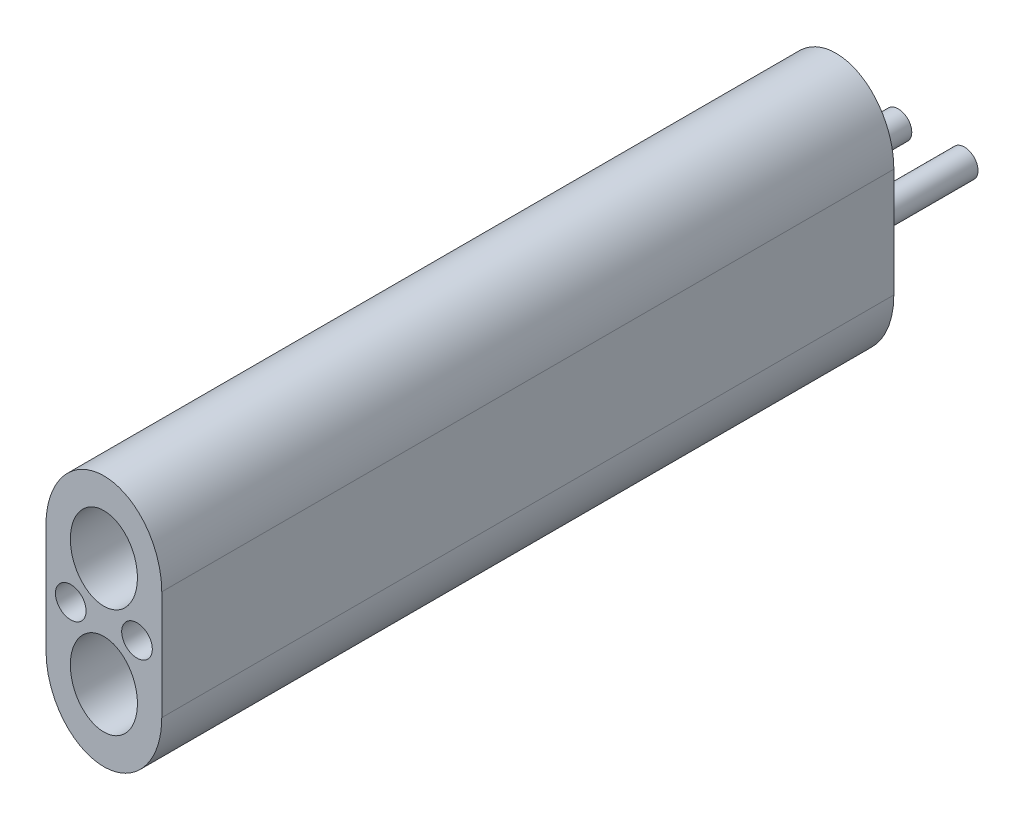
SolidWorks part; units mm, degrees
ref_plane "Front Plane" through (0, 0, 0) normal (0, 0, 1) x (1, 0, 0)
ref_plane "Top Plane" through (0, 0, 0) normal (0, 1, 0) x (1, 0, 0)
ref_plane "Right Plane" through (0, 0, 0) normal (1, 0, 0) x (0, 0, -1)
sketch "Sketch4" plane through (0, 0, 0) normal (0, 0, 1) x (1, 0, 0)
  line L1 (-8.5, 0) -> (8.5, 0)
  ellipse E0 centre (0, 0) end of major axis (0, 10.5) minor radius 8.5 (8.5, 0) -> (-8.5, 0) ccw
  dimension "D2" = 8.5
sketch "Sketch5" plane through (0, 0, 0) normal (1, 0, 0) x (0, 0, -1)
  ellipse E0 centre (0, -8) end of major axis (-15, -8) minor radius 8 (0, 0) -> (0, -16) ccw
  dimension "D1" = 16
sweep "Sweep1" add profiles "Sketch4" path "Sketch5"
sketch "Sketch6" plane through (0, 0, 0) normal (0, 0, -1) x (-1, 0, 0)
  line L0 (-8.5, -16) -> (-8.5, 0)
  line L1 (-8.5, 0) -> (8.5, 0)
  line L2 (8.5, 0) -> (8.5, -16)
  line L3 (8.5, -16) -> (-8.5, -16)
extrude "Boss-Extrude1" add sketch "Sketch6" against normal up to body
sketch "Sketch7" plane through (0, 0, 0) normal (0, 0, -1) x (-1, 0, 0)
  ellipse E0 centre (0, 0) end of major axis (0, 6.0789) minor radius 4.9211
sketch "Sketch8" plane through (0, 0, 0) normal (1, 0, 0) x (0, 0, -1)
  line L1 (0, 0) -> (-7, 0)
  line L2 (0, -6.0789) -> (0, 6.0789) construction
  line L3 (0, -16) -> (-7, -16)
  arc A1 (-7, 0) -> (-7, -16) centre (-7, -8) ccw
sweep "Cut-Sweep1" cut profiles "Sketch7" path "Sketch8"
sketch "Sketch9" plane through (0, 0, 0) normal (0, 0, -1) x (-1, 0, 0)
  line L2 (-8.5, 0) -> (-8.5, -16)
  line L3 (8.5, -16) -> (8.5, 0)
  line L4 (-8.5, 0) -> (-8.5, -16)
  line L5 (8.5, -16) -> (8.5, 0)
  ellipse E0 centre (0, 0) end of major axis (0, 6.0789) minor radius 4.9211 construction
  ellipse E1 centre (0, -16) end of major axis (0, -22.0789) minor radius 4.9211 construction
  ellipse E2 centre (0, 0) end of major axis (0, 10.5) minor radius 8.5 (8.5, 0) -> (-8.5, 0) ccw
  ellipse E3 centre (0, -16) end of major axis (0, -26.5) minor radius 8.5 (-8.5, -16) -> (8.5, -16) ccw
  ellipse E4 centre (0, 0) end of major axis (0, 10.5) minor radius 8.5 (8.5, 0) -> (-8.5, 0) ccw
  ellipse E5 centre (0, -16) end of major axis (0, -26.5) minor radius 8.5 (-8.5, -16) -> (8.5, -16) ccw
  ellipse E6 centre (0, 0) end of major axis (0, 6.0789) minor radius 4.9211
  ellipse E7 centre (0, -16) end of major axis (0, -22.0789) minor radius 4.9211
  dimension "D1" = 0
extrude "Boss-Extrude2" add sketch "Sketch9" along normal blind 40
sketch "Sketch10" plane through (0, 0, 0) normal (1, 0, 0) x (0, 0, -1)
  line L0 (0, 10.5) -> (0, -26.5)
  line L1 (0, -26.5) -> (-32.8569, -26.5)
  line L2 (-32.8569, -26.5) -> (-32.8569, 10.5)
  line L3 (-32.8569, 10.5) -> (0, 10.5)
extrude "Cut-Extrude1" cut sketch "Sketch10" along normal through all both and the other way through all
sketch "Sketch12" plane through (0, 0, 0) normal (0, 0, 1) x (1, 0, 0)
  line L2 (-8.5, 0) -> (-8.5, -16)
  line L3 (8.5, -16) -> (8.5, 0)
  line L4 (-8.5, 0) -> (-8.5, -16)
  line L5 (8.5, -16) -> (8.5, 0)
  ellipse E0 centre (0, 0) end of major axis (0, 6.0789) minor radius 4.9211 construction
  ellipse E1 centre (0, -16) end of major axis (0, -22.0789) minor radius 4.9211 construction
  ellipse E2 centre (0, -16) end of major axis (0, -26.5) minor radius 8.5 (-8.5, -16) -> (8.5, -16) ccw
  ellipse E3 centre (0, 0) end of major axis (0, 10.5) minor radius 8.5 (8.5, 0) -> (-8.5, 0) ccw
  ellipse E4 centre (0, -16) end of major axis (0, -26.5) minor radius 8.5 (-8.5, -16) -> (8.5, -16) ccw
  ellipse E5 centre (0, 0) end of major axis (0, 10.5) minor radius 8.5 (8.5, 0) -> (-8.5, 0) ccw
  ellipse E6 centre (0, 0) end of major axis (0, 6.0789) minor radius 4.9211
  ellipse E7 centre (0, -16) end of major axis (0, -22.0789) minor radius 4.9211
  dimension "D1" = 0
extrude "Boss-Extrude5" add sketch "Sketch12" along normal blind 67.5
sketch "Sketch13" plane through (0, 0, -40) normal (0, 0, -1) x (-1, 0, 0)
  circle A0 centre (-4.8631, -8) radius 2
  circle A1 centre (4.8631, -8) radius 2
  dimension "D2" = 4
extrude "Boss-Extrude7" add sketch "Sketch13" along normal blind 14 contours A1 | A0
sketch "Sketch15" plane through (0, 0, 67.5) normal (0, 0, 1) x (1, 0, 0)
  circle A0 centre (-4.8631, -8) radius 2.25
  circle A1 centre (4.8631, -8) radius 2.25
  dimension "D1" = 4.5
extrude "Cut-Extrude2" cut sketch "Sketch15" against normal blind 15
